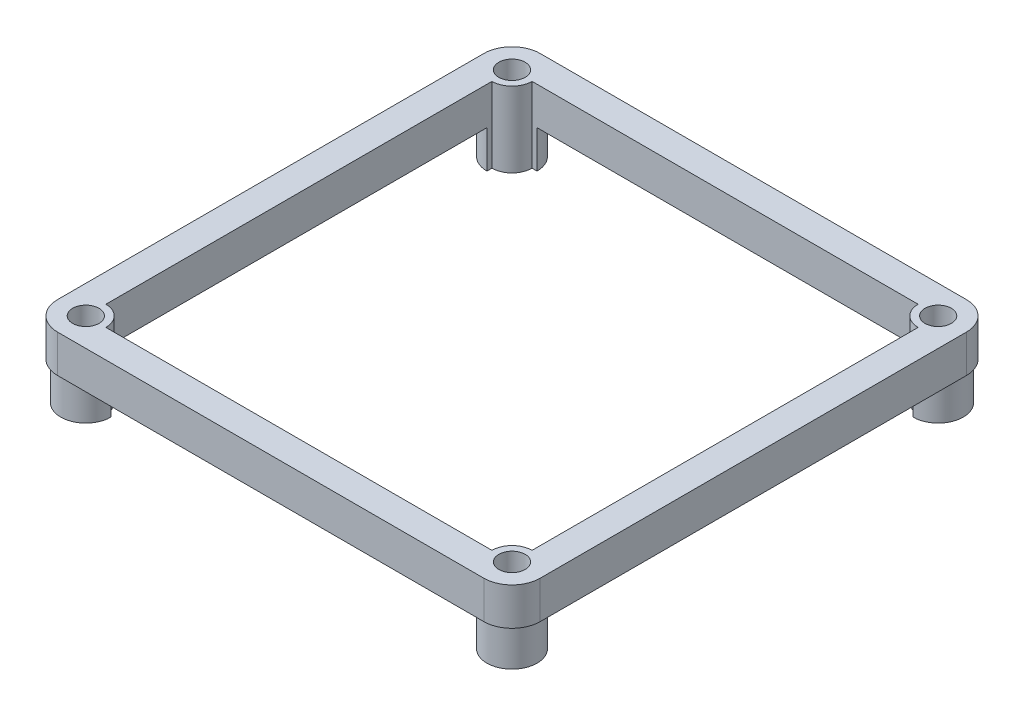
SolidWorks part; units mm, degrees
ref_plane "Front Plane" through (0, 0, 0) normal (0, 0, 1) x (1, 0, 0)
ref_plane "Top Plane" through (0, 0, 0) normal (0, 1, 0) x (1, 0, 0)
ref_plane "Right Plane" through (0, 0, 0) normal (1, 0, 0) x (0, 0, -1)
sketch "Sketch1" plane through (0, 0, 0) normal (0, 1, 0) x (1, 0, 0)
  line L0 (0, 32) -> (0, 32.4)
  line L1 (2, 34) -> (1.6, 34)
  line L2 (32, 34) -> (32.4, 34)
  line L3 (34, 32) -> (34, 32.4)
  line L4 (32, 0) -> (32.4, 0)
  line L5 (34, 2) -> (34, 1.6)
  line L6 (0, 2) -> (0, 1.6)
  line L7 (2, 0) -> (1.6, 0)
  circle A0 centre (0, 0) radius 1.05
  circle A1 centre (34, 0) radius 1.05
  circle A2 centre (34, 34) radius 1.05
  circle A3 centre (0, 34) radius 1.05
  arc A4 (1.6, 0) -> (0, 1.6) centre (0, 0) ccw
  arc A5 (0, 32.4) -> (1.6, 34) centre (0, 34) ccw
  arc A6 (32.4, 34) -> (34, 32.4) centre (34, 34) ccw
  arc A7 (34, 1.6) -> (32.4, 0) centre (34, 0) ccw
  arc A8 (2, 34) -> (0, 32) centre (0, 34) ccw
  arc A9 (32, 34) -> (34, 32) centre (34, 34) cw
  arc A10 (0, 2) -> (2, 0) centre (0, 0) ccw
  arc A11 (34, 2) -> (32, 0) centre (34, 0) cw
  point P9 (0, 0)
  dimension "D1" = 34
  dimension "D3" = 2.1
  dimension "D4" = 2
  dimension "D5" = 1.6
  dimension "D2" = 34
extrude "Boss-Extrude1" add sketch "Sketch1" along normal blind 6
sketch "Sketch4" plane through (0, 6, 0) normal (0, 1, 0) x (1, 0, 0)
  line L0 (-2.25, 0) -> (-2.25, 34)
  line L1 (0, 36.25) -> (34, 36.25)
  line L2 (36.25, 34) -> (36.25, 0)
  line L3 (34, -2.25) -> (0, -2.25)
  line L4 (32.4, 0) -> (32, 0) construction
  line L5 (34, 1.6) -> (34, 32.4)
  line L6 (32.4, 34) -> (1.6, 34)
  line L7 (0, 32.4) -> (0, 1.6)
  line L8 (1.6, 0) -> (32.4, 0)
  arc A0 (0, 36.25) -> (-2.25, 34) centre (0, 34) ccw
  arc A1 (34, 36.25) -> (36.25, 34) centre (34, 34) cw
  arc A2 (36.25, 0) -> (34, -2.25) centre (34, 0) cw
  arc A3 (0, -2.25) -> (-2.25, 0) centre (0, 0) cw
  arc A4 (34, 1.6) -> (32.4, 0) centre (34, 0) cw
  arc A5 (34, 32.4) -> (32.4, 34) centre (34, 34) ccw
  arc A7 (32.4, 34) -> (34, 32.4) centre (34, 34) ccw construction
  arc A8 (1.6, 34) -> (0, 32.4) centre (0, 34) ccw
  arc A9 (0, 1.6) -> (1.6, 0) centre (0, 0) ccw
  arc A10 (1.6, 0) -> (0, 1.6) centre (0, 0) ccw construction
  point P37 (0, 0)
  point P38 (0, 0)
  point P39 (0, 0)
  point P40 (0, 0)
  dimension "D1" = 2.25
extrude "Boss-Extrude2" add sketch "Sketch4" against normal blind 3
